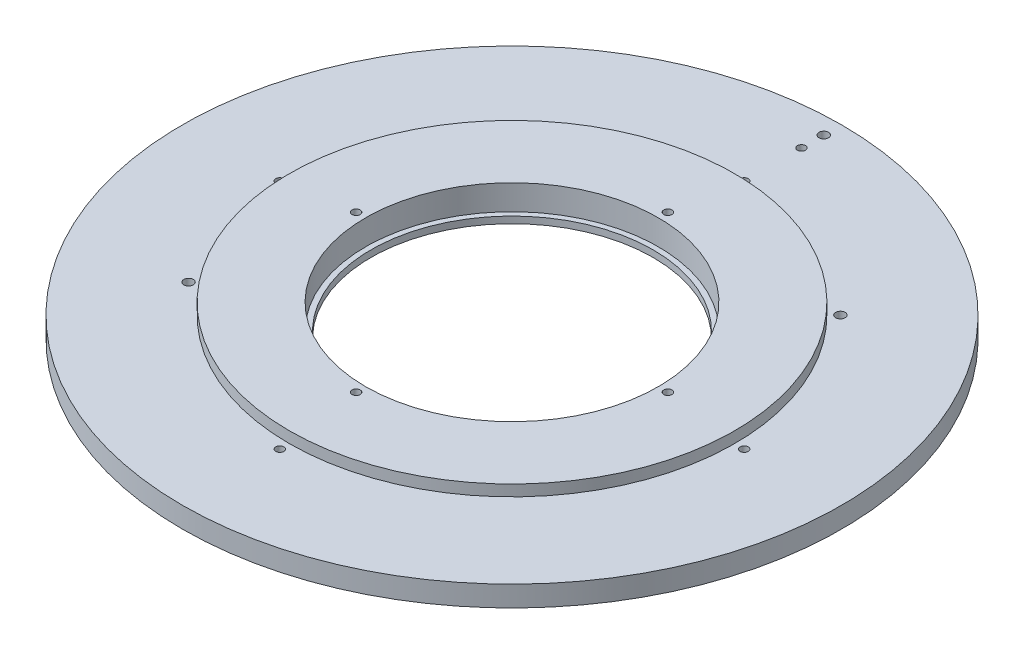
SolidWorks part; units mm, degrees
ref_plane "FRONT" through (0, 0, 0) normal (0, 0, 1) x (1, 0, 0)
ref_plane "TOP" through (0, 0, 0) normal (0, 1, 0) x (1, 0, 0)
ref_plane "RIGHT" through (0, 0, 0) normal (1, 0, 0) x (0, 0, -1)
ref_plane "PlateCamBtmPlane" through (0, 1203.325, 0) normal (0, 1, 0) x (-1, 0, 0)
sketch "Sketch1" plane through (0, 1203.325, 0) normal (0, 1, 0) x (-1, 0, 0)
  line L0 (0, 0) -> (-166.6875, 0) construction
  line L1 (-127, 0) -> (-130.9626, -6.8635) construction
  line L2 (0, 0) -> (-165.7744, -17.4236) construction
  line L3 (0, 0) -> (-163.045, -34.6563) construction
  line L4 (0, 0) -> (-166.4591, -8.7237) construction
  line L5 (0, 0) -> (-164.6353, -26.0757) construction
  line L6 (-130.9626, -6.8635) -> (-134.678, -14.1552) construction
  line L7 (-134.678, -14.1552) -> (-138.1152, -21.8753) construction
  line L8 (-138.1152, -21.8753) -> (-141.2424, -30.022) construction
  line L9 (0, 0) -> (-161.0078, -43.1419) construction
  line L10 (0, 0) -> (-158.5292, -51.5093) construction
  line L11 (-141.2424, -30.022) -> (-144.0269, -38.5919) construction
  line L12 (-144.0269, -38.5919) -> (-146.4352, -47.5797) construction
  line L13 (0, 0) -> (-155.6162, -59.7355) construction
  line L14 (0, 0) -> (-152.2766, -67.7979) construction
  line L15 (0, 0) -> (-148.5197, -75.6745) construction
  line L16 (-146.4352, -47.5797) -> (-148.4329, -56.978) construction
  line L17 (-148.4329, -56.978) -> (-149.985, -66.7776) construction
  line L18 (-149.985, -66.7776) -> (-150.4981, -71.6593) construction
  line L19 (-150.4981, -71.6593) -> (0, 0) construction
  arc A0 (-148.5197, -75.6745) -> (-150.4981, -71.6593) centre (0, 0) ccw construction
  circle A1 centre (0, 0) radius 127 construction
  arc A2 (-127, 0) -> (-150.4981, -71.6593) centre (13.9855, -85.9134) ccw
  dimension "D1" = 166.6875
  dimension "D2" = 127
  dimension "D22" = 165.1
  dimension "D3" = 60
  dimension "D4" = 6
  dimension "D5" = 12
  dimension "D6" = 3
  dimension "D7" = 9
  dimension "D8" = 63
  dimension "D9" = 66
  dimension "D10" = 69
  dimension "D11" = 15
  dimension "D12" = 18
  dimension "D13" = 72
  dimension "D14" = 75
  dimension "D15" = 21
  dimension "D16" = 24
  dimension "D17" = 27
  dimension "D18" = 78
  dimension "D19" = 81
  dimension "D20" = 84
  dimension "D21" = 58.539
sketch "Sketch2" plane through (0, 0, 0) normal (0, 1, 0) x (1, 0, 0)
  line L0 (0, 0) -> (166.6875, 0) construction
  line L1 (0, 0) -> (166.6875, 0) construction
  line L2 (-13.9855, 85.9134) -> (130.0696, 5.2526) construction
  line L3 (0, 0) -> (126.8599, -5.964) construction
  line L4 (0, 0) -> (146.7885, 78.98) construction
  line L5 (149.5855, 63.4962) -> (-13.9855, 85.9134) construction
  arc A0 (126.8599, -5.964) -> (130.0696, 5.2526) centre (152.2319, -7.1567) cw
  circle A1 centre (0, 0) radius 127 construction
  arc A2 (146.7885, 78.98) -> (166.6875, 0) centre (0, 0) ccw construction
  arc A3 (113.1578, 57.6568) -> (126.8599, -5.964) centre (0, 0) ccw construction
  arc A4 (130.0696, 5.2526) -> (149.5855, 63.4962) centre (-13.9855, 85.9134) ccw
  arc A5 (146.7885, 78.98) -> (149.5855, 63.4962) centre (124.4208, 66.945) cw
  point P13 (127, 0)
  dimension "D2" = 166.6875
  dimension "D3" = 25.4
  dimension "D4" = 25.4
  dimension "D1" = 165.1
sketch "PathSketch" plane through (0, 1203.325, 0) normal (0, 1, 0) x (1, 0, 0)
  line L0 (0, 0) -> (122.6726, 32.87) construction
  line L1 (0, 0) -> (166.6875, 0) construction
  line L2 (0, 0) -> (107.1447, 127.69) construction
  line L3 (0, 0) -> (-148.5197, -75.6745) construction
  line L4 (114.9122, 116.2713) -> (97.1274, 169.577) construction
  line L5 (107.1447, 127.69) -> (145.7517, 95.2949) construction
  line L6 (-148.5197, -75.6745) -> (-121.3507, -128.9966) construction
  line L7 (0, 0) -> (-59.6229, -112.1343) construction
  line L8 (-139.1409, -85.8117) -> (-101.9135, -108.5805) construction
  line L9 (0, 0) -> (-72.1163, -108.9558) construction
  arc A0 (107.1447, 127.69) -> (-148.5197, -75.6745) centre (0, 0) ccw construction
  arc A1 (-59.6229, -112.1343) -> (122.6726, 32.87) centre (0, 0) ccw construction
  arc A2 (122.6726, 32.87) -> (122.0193, 42.7207) centre (147.2071, 39.444) cw construction
  arc A3 (122.0193, 42.7207) -> (114.9122, 116.2713) centre (-41.7011, 64.0192) ccw construction
  arc A4 (107.1447, 127.69) -> (114.9122, 116.2713) centre (90.8179, 108.2325) cw construction
  arc A5 (-148.5197, -75.6745) -> (-139.1409, -85.8117) centre (-125.8881, -64.1432) ccw construction
  arc A6 (-139.1409, -85.8117) -> (-69.0742, -109.2819) centre (-52.9977, 55.0335) ccw construction
  arc A7 (-69.0742, -109.2819) -> (-59.6229, -112.1343) centre (-71.5475, -134.5612) cw construction
  arc A16 (-135.8012, -80.3512) -> (-68.4509, -102.9115) centre (-52.9977, 55.0335) ccw
  arc A17 (-142.8165, -72.7686) -> (-135.8012, -80.3512) centre (-125.8881, -64.1432) ccw
  arc A18 (103.0303, 122.7867) -> (-142.8165, -72.7686) centre (0, 0) ccw
  arc A19 (103.0303, 122.7867) -> (108.8404, 114.2455) centre (90.8179, 108.2325) cw
  arc A20 (115.672, 43.5464) -> (108.8404, 114.2455) centre (-41.7011, 64.0192) ccw
  arc A21 (116.4899, 31.2134) -> (115.672, 43.5464) centre (147.2071, 39.444) cw
  arc A22 (-56.6179, -106.4828) -> (116.4899, 31.2134) centre (0, 0) ccw
  arc A23 (-68.4509, -102.9115) -> (-56.6179, -106.4828) centre (-71.5475, -134.5612) cw
  dimension "D1" = 166.6875
  dimension "D2" = 127
  dimension "D4" = 25.4
  dimension "D5" = 165.1
  dimension "D7" = 25.4
  dimension "D8" = 31.549
  dimension "D11" = 25.4
  dimension "D12" = 165.1
  dimension "D13" = 25.4
  dimension "D3" = 15
  dimension "D6" = 35
  dimension "D9" = 35
  dimension "D10" = 207
  dimension "D14" = 31.549
  dimension "D15" = 236.5
  dimension "D16" = 6.4008
sketch "Sketch3" plane through (0, 1203.325, 0) normal (0, 1, 0) x (-1, 0, 0)
  circle A16 centre (0, 0) radius 164.4579
extrude "Base-Extrude" add sketch "Sketch3" along normal blind 15.875
sketch "Sketch4" plane through (0, 1219.2, 0) normal (0, 1, 0) x (-1, 0, 0)
  circle A1 centre (0, 0) radius 111.125
  circle A2 centre (0, 0) radius 182.5625
  dimension "D2" = 365.125
  dimension "D1" = 222.25
extrude "Cut-Extrude1" cut sketch "Sketch4" against normal blind 5.5562
sketch "Sketch6" plane through (0, 1219.2, 0) normal (0, 1, 0) x (-1, 0, 0)
  circle A0 centre (0, 0) radius 73.0313
  dimension "D1" = 146.0627
extrude "Cut-Extrude2" cut sketch "Sketch6" against normal blind 12.5476
sketch "Sketch7" plane through (0, 1206.6524, 0) normal (0, 1, 0) x (-1, 0, 0)
  circle A0 centre (0, 0) radius 70.4215
  dimension "D1" = 140.843
extrude "Cut-Extrude3" cut sketch "Sketch7" against normal through all
sketch " kdonfastener loc sketch" plane through (0, 1219.2, 0) normal (0, 1, 0) x (-1, 0, 0)
  line L0 (0, -87.0199) -> (0, 85.1831) construction
  line L1 (85.1905, 0) -> (-83.7428, 0) construction
  circle A0 centre (0, 0) radius 77.7875 construction
  dimension "D1" = 155.575
sketch "Sketch9" plane through (-78.6348, 1219.2, 20.2743) normal (0, 1, 0) x (-1, 0, 0)
  line L0 (6.5557, -20.2743) -> (-162.3776, -20.2743) construction
  circle A0 centre (-78.6348, -20.2743) radius 77.7875 construction
  point P0 (-0.8473, -20.2743)
sketch "Sketch10" plane through (-77.7875, 1219.2, 0) normal (1, 0, 0) x (0, 0, 1)
  line L0 (0, 0) -> (0, 25.3433)
  line L1 (0, 25.3433) -> (2.0193, 24.13)
  line L2 (2.0193, 24.13) -> (2.0193, 0)
  line L4 (2.0193, 0) -> (0, 0)
  line L6 (0, 25.3433) -> (-2.0193, 24.13) construction
  line L7 (0, -4.2442) -> (0, 117.3081) construction
  dimension "Diameter" = 4.0386
  dimension "Depth" = 24.13
  dimension "Drill Angle" = 118
hole_wizard "TAP10-321" positions "Sketch9" profile "Sketch10" legacy
sketch "Sketch11" plane through (11.5047, 1219.2, 113.7109) normal (0, 1, 0) x (-1, 0, 0)
  line L0 (11.5047, -200.7308) -> (11.5047, -28.5278) construction
  circle A0 centre (11.5047, -113.7109) radius 77.7875 construction
  point P0 (11.5047, -35.9234)
sketch "Sketch12" plane through (0, 1219.2, 77.7875) normal (1, 0, 0) x (0, 0, 1)
  line L0 (0, 0) -> (0, 25.3433)
  line L1 (0, 25.3433) -> (2.0193, 24.13)
  line L2 (2.0193, 24.13) -> (2.0193, 0)
  line L4 (2.0193, 0) -> (0, 0)
  line L6 (0, 25.3433) -> (-2.0193, 24.13) construction
  line L7 (0, -4.2442) -> (0, 117.3081) construction
  dimension "Diameter" = 4.0386
  dimension "Depth" = 24.13
  dimension "Drill Angle" = 118
hole_wizard "TAP10-322" positions "Sketch11" profile "Sketch12" legacy
sketch "Sketch13" plane through (89.9734, 1219.2, 37.6899) normal (0, 1, 0) x (-1, 0, 0)
  line L0 (175.164, -37.6899) -> (6.2307, -37.6899) construction
  circle A0 centre (89.9734, -37.6899) radius 77.7875 construction
  point P0 (12.1859, -37.6899)
sketch "Sketch14" plane through (77.7875, 1219.2, 0) normal (1, 0, 0) x (0, 0, 1)
  line L0 (0, 0) -> (0, 25.3433)
  line L1 (0, 25.3433) -> (2.0193, 24.13)
  line L2 (2.0193, 24.13) -> (2.0193, 0)
  line L4 (2.0193, 0) -> (0, 0)
  line L6 (0, 25.3433) -> (-2.0193, 24.13) construction
  line L7 (0, -4.2442) -> (0, 117.3081) construction
  dimension "Diameter" = 4.0386
  dimension "Depth" = 24.13
  dimension "Drill Angle" = 118
hole_wizard "TAP10-323" positions "Sketch13" profile "Sketch14" legacy
sketch "Sketch15" plane through (11.2436, 1219.2, -53.2861) normal (0, 1, 0) x (-1, 0, 0)
  line L0 (11.2436, -33.7338) -> (11.2436, 138.4692) construction
  circle A0 centre (11.2436, 53.2861) radius 77.7875 construction
  point P0 (11.2436, -24.5014)
sketch "Sketch16" plane through (0, 1219.2, -77.7875) normal (1, 0, 0) x (0, 0, 1)
  line L0 (0, 0) -> (0, 25.3433)
  line L1 (0, 25.3433) -> (2.0193, 24.13)
  line L2 (2.0193, 24.13) -> (2.0193, 0)
  line L4 (2.0193, 0) -> (0, 0)
  line L6 (0, 25.3433) -> (-2.0193, 24.13) construction
  line L7 (0, -4.2442) -> (0, 117.3081) construction
  dimension "Diameter" = 4.0386
  dimension "Depth" = 24.13
  dimension "Drill Angle" = 118
hole_wizard "TAP10-324" positions "Sketch15" profile "Sketch16" legacy
sketch "ocam fastener loc sketch" plane through (0, 0, 0) normal (0, 1, 0) x (1, 0, 0)
  line L0 (0, 150.0088) -> (0, -150.0088) construction
  line L1 (0, 0) -> (135.9866, 135.9866) construction
  line L2 (-179.7353, 0) -> (179.7353, 0) construction
  line L3 (0, 0) -> (-136.7004, -95.7187) construction
  circle A0 centre (0, 0) radius 115.8875 construction
  dimension "D1" = 231.775
  dimension "D2" = 45
  dimension "D3" = 215
sketch "Sketch18" plane through (9.4226, 1213.6437, 147.1246) normal (0, 1, 0) x (-1, 0, 0)
  line L0 (9.4226, -297.1334) -> (9.4226, 2.8841) construction
  circle A0 centre (9.4226, -147.1246) radius 115.8875 construction
  point P0 (9.4226, -31.2371)
sketch "Sketch19" plane through (0, 1213.6437, 115.8875) normal (1, 0, 0) x (0, 0, 1)
  line L0 (0, 0) -> (0, 25.3433)
  line L1 (0, 25.3433) -> (2.0193, 24.13)
  line L2 (2.0193, 24.13) -> (2.0193, 0)
  line L4 (2.0193, 0) -> (0, 0)
  line L6 (0, 25.3433) -> (-2.0193, 24.13) construction
  line L7 (0, -4.2442) -> (0, 117.3081) construction
  dimension "Diameter" = 4.0386
  dimension "Depth" = 24.13
  dimension "Drill Angle" = 118
hole_wizard "TAP10-325" positions "Sketch18" profile "Sketch19" legacy
sketch "Sketch20" plane through (122.1141, 1213.6437, 30.9883) normal (0, 1, 0) x (-1, 0, 0)
  line L0 (301.8494, -30.9883) -> (-57.6212, -30.9883) construction
  circle A0 centre (122.1141, -30.9883) radius 115.8875 construction
  point P0 (6.2266, -30.9883)
sketch "Sketch21" plane through (115.8875, 1213.6437, 0) normal (1, 0, 0) x (0, 0, 1)
  line L0 (0, 0) -> (0, 25.3433)
  line L1 (0, 25.3433) -> (2.0193, 24.13)
  line L2 (2.0193, 24.13) -> (2.0193, 0)
  line L4 (2.0193, 0) -> (0, 0)
  line L6 (0, 25.3433) -> (-2.0193, 24.13) construction
  line L7 (0, -4.2442) -> (0, 117.3081) construction
  dimension "Diameter" = 4.0386
  dimension "Depth" = 24.13
  dimension "Drill Angle" = 118
hole_wizard "TAP10-326" positions "Sketch20" profile "Sketch21" legacy
sketch "Sketch22" plane through (7.4639, 1213.6437, -88.4825) normal (0, 1, 0) x (-1, 0, 0)
  line L0 (7.4639, -61.5262) -> (7.4639, 238.4913) construction
  circle A0 centre (7.4639, 88.4825) radius 115.8875 construction
  point P0 (7.4639, -27.405)
sketch "Sketch23" plane through (0, 1213.6437, -115.8875) normal (1, 0, 0) x (0, 0, 1)
  line L0 (0, 0) -> (0, 25.3433)
  line L1 (0, 25.3433) -> (2.0193, 24.13)
  line L2 (2.0193, 24.13) -> (2.0193, 0)
  line L4 (2.0193, 0) -> (0, 0)
  line L6 (0, 25.3433) -> (-2.0193, 24.13) construction
  line L7 (0, -4.2442) -> (0, 117.3081) construction
  dimension "Diameter" = 4.0386
  dimension "Depth" = 24.13
  dimension "Drill Angle" = 118
hole_wizard "TAP10-327" positions "Sketch22" profile "Sketch23" legacy
sketch "Sketch24" plane through (-113.6436, 1213.6437, 30.8177) normal (0, 1, 0) x (-1, 0, 0)
  line L0 (66.0917, -30.8177) -> (-293.3789, -30.8177) construction
  circle A0 centre (-113.6436, -30.8177) radius 115.8875 construction
  point P0 (2.2439, -30.8177)
sketch "Sketch25" plane through (-115.8875, 1213.6437, 0) normal (1, 0, 0) x (0, 0, 1)
  line L0 (0, 0) -> (0, 25.3433)
  line L1 (0, 25.3433) -> (2.0193, 24.13)
  line L2 (2.0193, 24.13) -> (2.0193, 0)
  line L4 (2.0193, 0) -> (0, 0)
  line L6 (0, 25.3433) -> (-2.0193, 24.13) construction
  line L7 (0, -4.2442) -> (0, 117.3081) construction
  dimension "Diameter" = 4.0386
  dimension "Depth" = 24.13
  dimension "Drill Angle" = 118
hole_wizard "TAP10-328" positions "Sketch24" profile "Sketch25" legacy
sketch "Sketch26" plane through (95.2794, 1213.6437, -58.2901) normal (0, 1, 0) x (-1, 0, 0)
  line L0 (95.2794, 58.2901) -> (-40.7073, -77.6966) construction
  circle A0 centre (95.2794, 58.2901) radius 115.8875 construction
  point P0 (13.3346, -23.6547)
sketch "Sketch27" plane through (81.9448, 1213.6437, -81.9448) normal (1, 0, 0) x (0, 0, 1)
  line L0 (0, 0) -> (0, 203.2)
  line L1 (0, 203.2) -> (2.1828, 203.2)
  line L2 (2.1828, 203.2) -> (2.1828, 14.2875)
  line L3 (2.1828, 14.2875) -> (2.3686, 14.2875)
  line L4 (2.3686, 14.2875) -> (2.3686, 0)
  line L5 (2.3686, 0) -> (0, 0)
  line L6 (0, 110) -> (0, -10) construction
  dimension "Diameter" = 4.3656
  dimension "Depth" = 203.2
  dimension "C-Bore Diameter" = 4.7371
  dimension "C-Bore Depth" = 14.2875
hole_wizard "Hole9" positions "Sketch26" profile "Sketch27" legacy
sketch "Sketch28" plane through (59.1419, 1213.6437, -64.1415) normal (0, 1, 0) x (-1, 0, 0)
  line L0 (-22.803, -15.4348) -> (-22.803, -16.8111)
  line L10 (-20.4344, -17.8033) -> (-21.8108, -17.8033)
  line L11 (-20.7517, -18.9876) -> (-21.9437, -18.2994)
  line L12 (-20.4704, -18.2146) -> (-21.8258, -17.9756)
  line L13 (-20.5772, -18.6134) -> (-21.8706, -18.1427)
  line L14 (-21.6187, -19.8545) -> (-22.3069, -18.6626)
  line L15 (-21.2805, -19.6177) -> (-22.1652, -18.5634)
  line L16 (-21.9929, -20.029) -> (-22.4636, -18.7357)
  line L17 (-20.9885, -19.3258) -> (-22.0429, -18.4411)
  line L18 (-22.3917, -20.1359) -> (-22.6307, -18.7804)
  line L20 (-22.803, -18.7955) -> (-22.803, -20.1719)
  line L21 (-23.1423, -16.871) -> (-23.613, -15.5776)
  line L22 (-22.9752, -16.8262) -> (-23.2142, -15.4708)
  line L23 (-23.299, -16.9441) -> (-23.9872, -15.7521)
  line L24 (-23.4407, -17.0433) -> (-24.3254, -15.9889)
  line L25 (-23.6622, -17.3072) -> (-24.8542, -16.619)
  line L26 (-23.563, -17.1656) -> (-24.6174, -16.2808)
  line L27 (-23.7951, -17.8033) -> (-25.1715, -17.8033)
  line L31 (-23.7801, -17.631) -> (-25.1355, -17.392)
  line L32 (-23.7353, -17.464) -> (-25.0287, -16.9932)
  circle A0 centre (-22.803, -17.8033) radius 2.3686
  circle A1 centre (-22.803, -17.8033) radius 0.9922
  dimension "D12" = 10
  dimension "D18" = 4.7371
  dimension "D19" = 1.9844
  dimension "D1" = 10
  dimension "D10" = 10
  dimension "D11" = 10
  dimension "D13" = 10
  dimension "D14" = 10
  dimension "D15" = 10
  dimension "D16" = 10
  dimension "D17" = 10
other "PF_.18751"
sketch "Sketch29" plane through (-97.2624, 1213.6437, 91.5504) normal (0, 1, 0) x (-1, 0, 0)
  line L0 (-97.2624, -91.5504) -> (39.438, 4.1683) construction
  circle A0 centre (-97.2624, -91.5504) radius 115.8875 construction
  point P0 (-2.3329, -25.0801)
sketch "Sketch30" plane through (-94.9295, 1213.6437, 66.4703) normal (1, 0, 0) x (0, 0, 1)
  line L0 (0, 0) -> (0, 203.2)
  line L1 (0, 203.2) -> (2.1828, 203.2)
  line L2 (2.1828, 203.2) -> (2.1828, 14.2875)
  line L3 (2.1828, 14.2875) -> (2.3686, 14.2875)
  line L4 (2.3686, 14.2875) -> (2.3686, 0)
  line L5 (2.3686, 0) -> (0, 0)
  line L6 (0, 110) -> (0, -10) construction
  dimension "Diameter" = 4.3656
  dimension "Depth" = 203.2
  dimension "C-Bore Diameter" = 4.7371
  dimension "C-Bore Depth" = 14.2875
hole_wizard "Hole10" positions "Sketch29" profile "Sketch30" legacy
sketch "Sketch31" plane through (-117.7324, 1213.6437, 84.2737) normal (0, 1, 0) x (-1, 0, 0)
  line L0 (-22.803, -15.4348) -> (-22.803, -16.8111)
  line L10 (-20.4344, -17.8033) -> (-21.8108, -17.8033)
  line L11 (-20.7517, -18.9876) -> (-21.9437, -18.2994)
  line L12 (-20.4704, -18.2146) -> (-21.8258, -17.9756)
  line L13 (-20.5772, -18.6134) -> (-21.8706, -18.1427)
  line L14 (-21.6187, -19.8545) -> (-22.3069, -18.6626)
  line L15 (-21.2805, -19.6177) -> (-22.1652, -18.5634)
  line L16 (-21.9929, -20.029) -> (-22.4636, -18.7357)
  line L17 (-20.9885, -19.3258) -> (-22.0429, -18.4411)
  line L18 (-22.3917, -20.1359) -> (-22.6307, -18.7804)
  line L20 (-22.803, -18.7955) -> (-22.803, -20.1719)
  line L21 (-23.1423, -16.871) -> (-23.613, -15.5776)
  line L22 (-22.9752, -16.8262) -> (-23.2142, -15.4708)
  line L23 (-23.299, -16.9441) -> (-23.9872, -15.7521)
  line L24 (-23.4407, -17.0433) -> (-24.3254, -15.9889)
  line L25 (-23.6622, -17.3072) -> (-24.8542, -16.619)
  line L26 (-23.563, -17.1656) -> (-24.6174, -16.2808)
  line L27 (-23.7951, -17.8033) -> (-25.1715, -17.8033)
  line L31 (-23.7801, -17.631) -> (-25.1355, -17.392)
  line L32 (-23.7353, -17.464) -> (-25.0287, -16.9932)
  circle A0 centre (-22.803, -17.8033) radius 2.3686
  circle A1 centre (-22.803, -17.8033) radius 0.9922
  dimension "D12" = 10
  dimension "D18" = 4.7371
  dimension "D19" = 1.9844
  dimension "D1" = 10
  dimension "D10" = 10
  dimension "D11" = 10
  dimension "D13" = 10
  dimension "D14" = 10
  dimension "D15" = 10
  dimension "D16" = 10
  dimension "D17" = 10
other "PF_.18752"
sketch "DropoutMtgHoles" plane through (0, 0, 0) normal (0, 1, 0) x (1, 0, 0)
  line L0 (-50, 0) -> (50, 0) construction
  line L1 (0, -50) -> (0, 50) construction
  point P1 (0, 155.575)
  point P2 (0, 144.4625)
  dimension "D1" = 144.4625
  dimension "D2" = 155.575
sketch "Sketch33" plane through (-7.5067, 1213.6438, -118.7185) normal (0, 1, 0) x (-1, 0, 0)
  point P0 (-7.5067, -25.744)
sketch "Sketch34" plane through (0, 1213.6438, -144.4625) normal (1, 0, 0) x (0, 0, 1)
  line L0 (0, 0) -> (0, 25.3433)
  line L1 (0, 25.3433) -> (2.0193, 24.13)
  line L2 (2.0193, 24.13) -> (2.0193, 0)
  line L4 (2.0193, 0) -> (0, 0)
  line L6 (0, 25.3433) -> (-2.0193, 24.13) construction
  line L7 (0, -4.2442) -> (0, 117.3081) construction
  dimension "Diameter" = 4.0386
  dimension "Depth" = 24.13
  dimension "Drill Angle" = 118
hole_wizard "TAP10-329" positions "Sketch33" profile "Sketch34" legacy
sketch "Sketch38" plane through (-6.0989, 1213.6438, -128.7615) normal (0, 1, 0) x (-1, 0, 0)
  point P0 (-6.0989, -26.8135)
sketch "Sketch39" plane through (0, 1213.6438, -155.575) normal (1, 0, 0) x (0, 0, 1)
  line L0 (0, 0) -> (0, 15.5991)
  line L1 (0, 15.5991) -> (2.1828, 14.2875)
  line L2 (2.1828, 14.2875) -> (2.1828, 7.1437)
  line L3 (2.1828, 7.1437) -> (2.394, 7.1437)
  line L4 (2.394, 0) -> (0, 0)
  line L5 (0, -11.3109) -> (0, 121.1557) construction
  line L6 (0, 15.5991) -> (-2.1828, 14.2875) construction
  line L7 (2.394, 7.1437) -> (2.394, 0)
  dimension "Depth" = 14.2875
  dimension "Drill Angle" = 118
  dimension "Diameter" = 4.3656
  dimension "C-Bore Diameter" = 4.7879
  dimension "C-Bore Depth" = 7.1437
hole_wizard "Hole13" positions "Sketch38" profile "Sketch39" legacy
sketch "Sketch40" plane through (-34.6912, 1213.6437, -138.7456) normal (0, 1, 0) x (-1, 0, 0)
  line L0 (-34.6912, -14.4354) -> (-34.6912, -19.2233)
  line L10 (-32.2973, -16.8294) -> (-37.0852, -16.8294)
  line L11 (-32.618, -18.0263) -> (-36.7645, -15.6324)
  line L12 (-32.3337, -17.2451) -> (-37.0488, -16.4137)
  line L13 (-32.4417, -17.6481) -> (-36.9408, -16.0106)
  line L14 (-33.4943, -18.9026) -> (-35.8882, -14.7561)
  line L15 (-33.1524, -18.6632) -> (-36.23, -14.9955)
  line L16 (-33.8725, -19.0789) -> (-35.51, -14.5798)
  line L17 (-32.8574, -18.3682) -> (-36.5251, -15.2906)
  line L18 (-34.2755, -19.1869) -> (-35.1069, -14.4718)
  circle A0 centre (-34.6912, -16.8294) radius 2.394
  dimension "D12" = 10
  dimension "D18" = 4.7879
  dimension "D1" = 10
  dimension "D10" = 10
  dimension "D11" = 10
  dimension "D13" = 10
  dimension "D14" = 10
  dimension "D15" = 10
  dimension "D16" = 10
  dimension "D17" = 10
other "SF_.18751"
